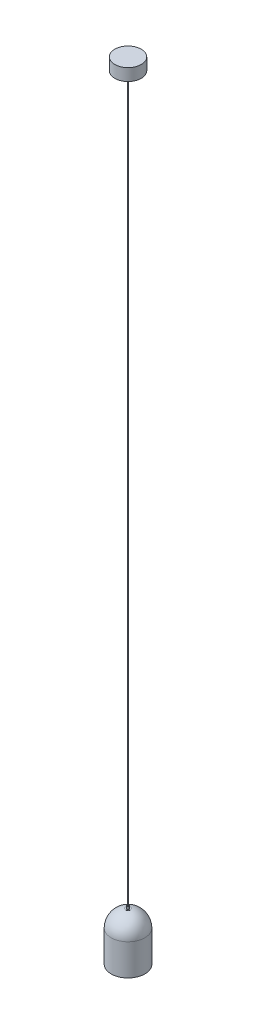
SolidWorks part; units mm, degrees
ref_plane "Alzado" through (0, 0, 0) normal (0, 0, 1) x (1, 0, 0)
ref_plane "Planta" through (0, 0, 0) normal (0, 1, 0) x (1, 0, 0)
ref_plane "Vista lateral" through (0, 0, 0) normal (1, 0, 0) x (0, 0, -1)
sketch "Croquis1" plane through (0, 0, 0) normal (0, 0, 1) x (1, 0, 0)
  line L0 (0, 0) -> (-70, 0)
  line L1 (0, 0) -> (0, 200)
  line L2 (0, 200) -> (0, 160.6502)
  line L3 (-70, 0) -> (-70, 130)
  arc A1 (0, 200) -> (-70, 130) centre (0, 130) ccw
revolve "Revolución1" add sketch "Croquis1" angle 360 about L1
shell "Vaciado1" thickness 3
ref_plane "Plano1" through (0, 200, 0) normal (0, 1, 0) x (1, 0, 0)
ref_plane "Plano2" through (0, 200, 0) normal (0, 1, 0) x (1, 0, 0)
sketch "Croquis3" plane through (0, 200, 0) normal (0, 1, 0) x (1, 0, 0)
  circle A0 centre (0, 0) radius 5
extrude "Saliente-Extruir1" add sketch "Croquis3" along normal blind 10 separate body
sketch "Croquis4" plane through (0, 200, 0) normal (0, 1, 0) x (1, 0, 0)
  circle A0 centre (0, 0) radius 10
extrude "Saliente-Extruir2" add sketch "Croquis4" along normal blind 1 separate body
sketch "Croquis5" plane through (0, 210, 0) normal (0, 1, 0) x (1, 0, 0)
  circle A0 centre (0, 0) radius 1.5
extrude "Saliente-Extruir3" add sketch "Croquis5" along normal blind 3000 separate body
sketch "Croquis6" plane through (0, 3210, 0) normal (0, 1, 0) x (1, 0, 0)
  circle A0 centre (0, 0) radius 54.991
  dimension "D1" = 109.982
extrude "Saliente-Extruir4" add sketch "Croquis6" along normal blind 50.038
